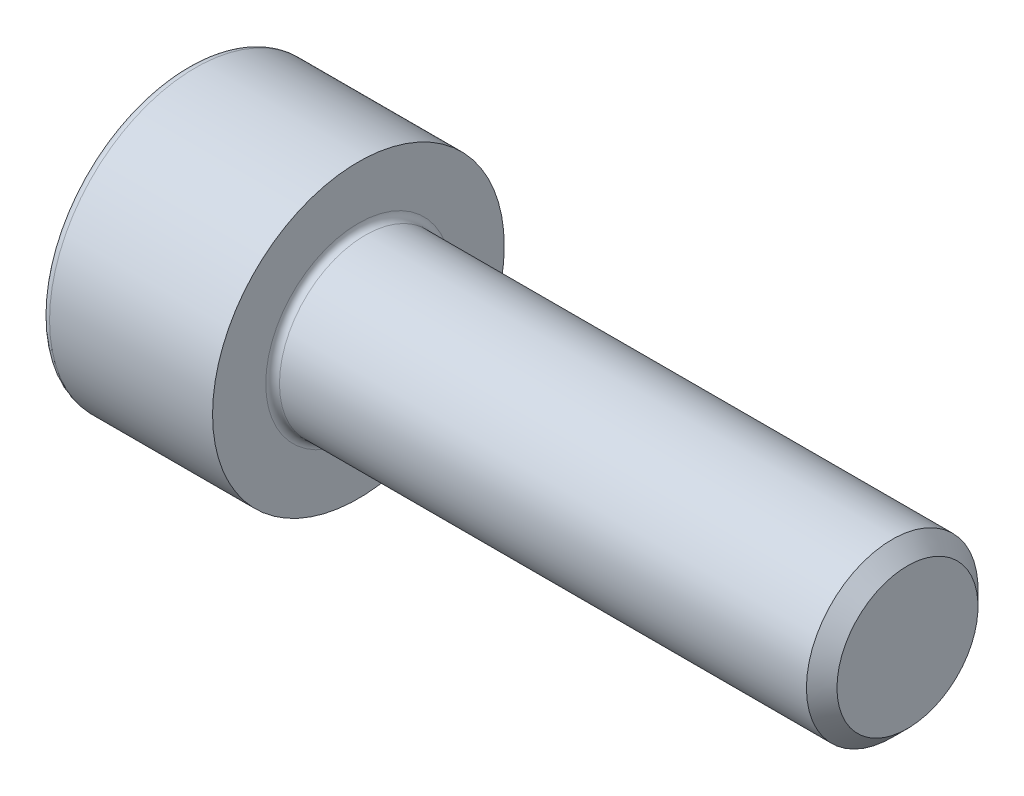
SolidWorks part; units mm, degrees
ref_plane "Plane1" through (0, 0, 0) normal (0, 0, 1) x (1, 0, 0)
ref_plane "Plane2" through (0, 0, 0) normal (0, 1, 0) x (1, 0, 0)
ref_plane "Plane3" through (0, 0, 0) normal (1, 0, 0) x (0, 0, -1)
revolve "Base-Revolve" add sketch "BodySke"
sketch "BodySke" plane through (0, 0, 0) normal (0, 0, 1) x (1, 0, 0)
  line L0 (0, 0) -> (0, 4.25)
  line L1 (0, 4.25) -> (5, 4.25)
  line L2 (5, 4.25) -> (5, 2.5)
  line L3 (5, 2.5) -> (20.555, 2.5)
  line L4 (21, 2.055) -> (21, 0)
  line L5 (21, 0) -> (0, 0)
  line L6 (-31.75, 0) -> (127, 0) construction
  line L8 (21, 2.055) -> (20.555, 2.5)
  line L10 (21, -2.055) -> (20.555, -2.5) construction
  line L11 (5.8, 9.525) -> (5.8, 3.175) construction
  line L12 (5, 9.525) -> (5, 3.175) construction
  line L13 (-39, 9.525) -> (-39, 3.175) construction
  dimension "Diameter" = 5
  dimension "Head_ht" = 5
  dimension "Length" = 16
  dimension "Body_ch_ang" = 45
  dimension "Head_dia" = 8.5
  dimension "Minor_dia" = 4.11
  dimension "Advance" = 0.8
  dimension "Thread_nom" = 16
  dimension "Thread_length" = 60
fillet "Fillet1" radius 0.2 1 edges at (5, 0, 2.5)
fillet "Fillet2" radius 0.25 1 edges at (0, 0, 4.25)
sketch "Sketch2" plane through (0, 0, 0) normal (0, 0, 1) x (1, 0, 0)
  line L0 (0, 2.042) -> (2.5, 2.042)
  line L1 (2.5, 2.042) -> (3.6789, 0)
  line L2 (-31.75, 0) -> (127, 0) construction
  line L3 (3.6789, 0) -> (0, 0)
  line L4 (0, 0) -> (0, 2.042)
  line L6 (0, 0) -> (47.625, 0) construction
  dimension "D1" = 2.042
  dimension "D2" = 60
  dimension "Depth" = 2.5
revolve "Hex-PreBroach" cut sketch "Sketch2" angle 360 about L6
sketch "Sketch3" plane through (0, 0, 0) normal (-1, 0, 0) x (0, 0.5, 0.866)
  line L0 (1.1789, 2.042) -> (-1.1789, 2.042)
  line L1 (-1.1789, 2.042) -> (-2.3579, 0)
  line L2 (1.1789, 2.042) -> (2.3579, 0)
  line L3 (1.1789, -2.042) -> (2.3579, 0)
  line L4 (1.1789, -2.042) -> (-1.1789, -2.042)
  line L5 (-1.1789, -2.042) -> (-2.3579, 0)
  dimension "D1" = 2.042
  dimension "D2" = 2.042
  dimension "Hex_size" = 4.084
extrude "Hex" cut sketch "Sketch3" against normal blind 2.5
sketch "ThdSchSke" plane through (0, 0, 0) normal (0, 0, 1) x (1, 0, 0)
  line L0 (7.4, -2.055) -> (7.0884, -2.5)
  line L1 (7.4, -2.055) -> (7.7116, -2.5)
  line L2 (7.7116, -2.5) -> (7.7116, -3.125)
  line L3 (-3.175, 0) -> (5.1513, 0) construction
  line L4 (0, 4) -> (0, -4) construction
  line L5 (7.7116, -3.125) -> (7.0884, -3.125)
  line L6 (7.0884, -3.125) -> (7.0884, -2.5)
  dimension "Thread_minor" = 4.11
  dimension "Diameter" = 5
  dimension "Start" = 7.4
  dimension "SideAngle" = 55
  dimension "VeeAngle" = 70
  dimension "Overcut" = 6.25
revolve "ThreadSchematic" cut sketch "ThdSchSke" angle 360 about L3
pattern_linear "ThdSchPat"
equation "\"D2@Sketch3\" = \"Hex_size@Sketch3\" / 2"
equation "\"D1@Sketch3\" = \"Hex_size@Sketch3\" / 2"
equation "\"D1@Sketch2\" = \"Hex_size@Sketch3\" / 2"
equation "\"Thread_minor@ThreadCosmetic\"  =  \"Minor_dia@BodySke\""
equation "\"Depth@Sketch2\" =  \"Key_eng@Hex\""
equation "\"Thread_length@ThreadCosmetic\" = ((sgn( (\"Length@BodySke\" - \"Advance@BodySke\" * 3.0) - \"Thread_nom@BodySke\" )-1)*( (\"Length@BodySke\" - \"Advance@BodySke\" * 3.0) - \"Thread_nom@BodySke\" ))/-2+ \"Thread_no"
equation "\"Thread_minor@ThdSchSke\" = \"Minor_dia@BodySke\""
equation "\"Diameter@ThdSchSke\" = \"Diameter@BodySke\""
equation "\"Overcut@ThdSchSke\" = \"Diameter@BodySke\" * 1.25"
equation "\"Start@ThdSchSke\" = \"Head_ht@BodySke\" + \"Length@BodySke\" - \"Thread_length@ThreadCosmetic\"  '---Non-countersunk---"
equation "\"Num_threads@ThdSchPat\" = int( \"Thread_length@ThreadCosmetic\" / \"Advance@BodySke\" + 0.999 )  + 1"
equation "\"Advance@ThdSchPat\" = \"Thread_length@ThreadCosmetic\" /  (\"Num_threads@ThdSchPat\" - 1) 'relax it"
equation "\"Num_threads@ThdSchPat\" = \"Num_threads@ThdSchPat\" - sgn( \"Num_threads@ThdSchPat\" - 1) '---chamfered tips only---"
